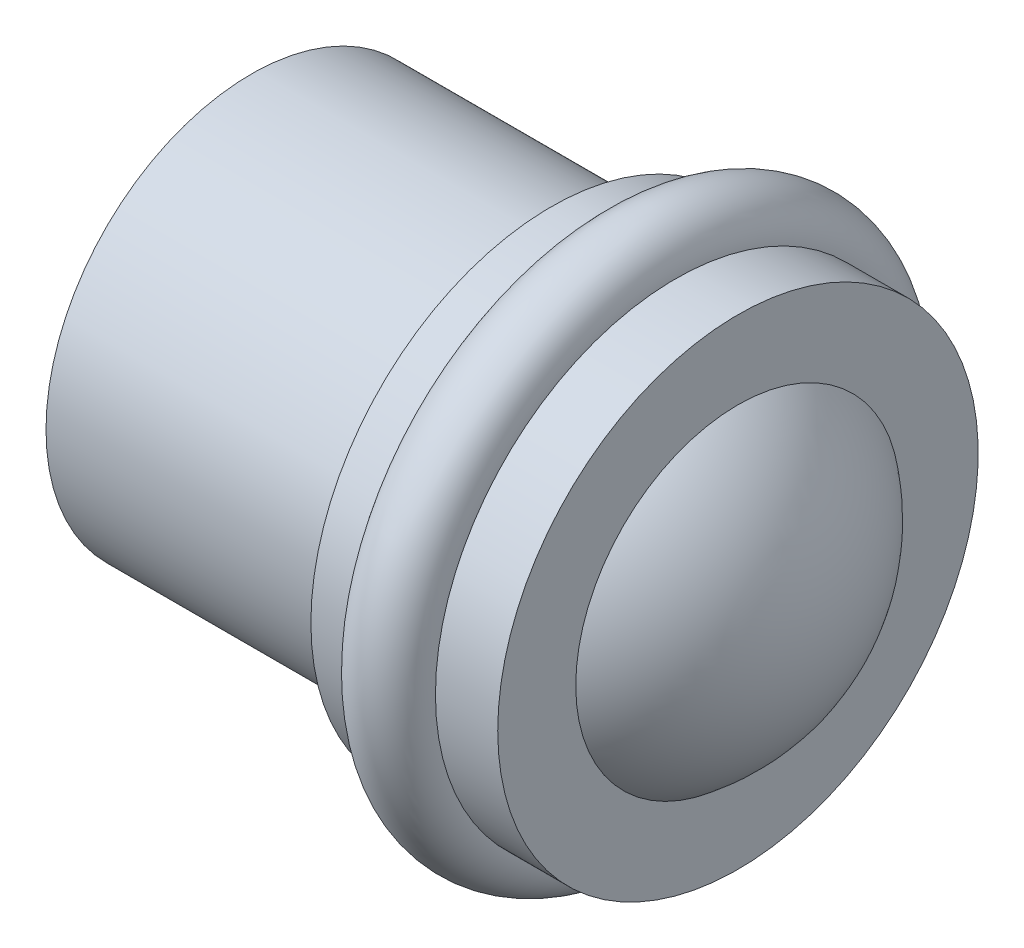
SolidWorks part; units mm, degrees
ref_plane "Front Plane" through (0, 0, 0) normal (0, 0, 1) x (1, 0, 0)
ref_plane "Top Plane" through (0, 0, 0) normal (0, 1, 0) x (1, 0, 0)
ref_plane "Right Plane" through (0, 0, 0) normal (1, 0, 0) x (0, 0, -1)
sketch "Sketch1" plane through (0, 0, 0) normal (0, 0, 1) x (1, 0, 0)
  line L0 (-3.5052, 0) -> (3.5052, 0) construction
  line L1 (-3.5052, 0) -> (-3.5052, 2.54)
  line L2 (-3.5052, 2.54) -> (0.2032, 2.54)
  line L3 (0.2032, 2.54) -> (0.2032, 2.9718)
  line L4 (0.2032, 2.9718) -> (0.7811, 2.9718)
  line L5 (1.7441, 2.9718) -> (2.5146, 2.9718)
  line L6 (2.5146, 2.9718) -> (2.5146, 2.0066)
  line L7 (-3.5052, 0) -> (3.5052, 0)
  arc A0 (0.7811, 2.9718) -> (1.7441, 2.9718) centre (1.2626, 2.9718) ccw
  arc A1 (2.5146, 2.0066) -> (3.5052, 0) centre (0.9776, 0) cw
  dimension "D1" = 4.0132
  dimension "H" = 0.9906
  dimension "D2" = 5.08
  dimension "D" = 5.9436
  dimension "L3" = 2.3114
  dimension "L2" = 0.5778
  dimension "L1" = 0.7705
  dimension "A" = 3.7084
revolve "Revolve1" add sketch "Sketch1" angle 360 about L0
sketch "Sketch2" plane through (0, 0, 0) normal (0, 0, 1) x (1, 0, 0)
  circle A0 centre (1.2626, 2.9718) radius 0.4815
  arc A1 (0.7811, 2.9718) -> (1.7441, 2.9718) centre (1.2626, 2.9718) ccw construction
revolve "Revolve2" add sketch "Sketch2" angle 360 about L7
equation "\"L2@Sketch1\" = \"L3@Sketch1\"/4"
equation "\"L1@Sketch1\" = \"L3@Sketch1\"/3"
